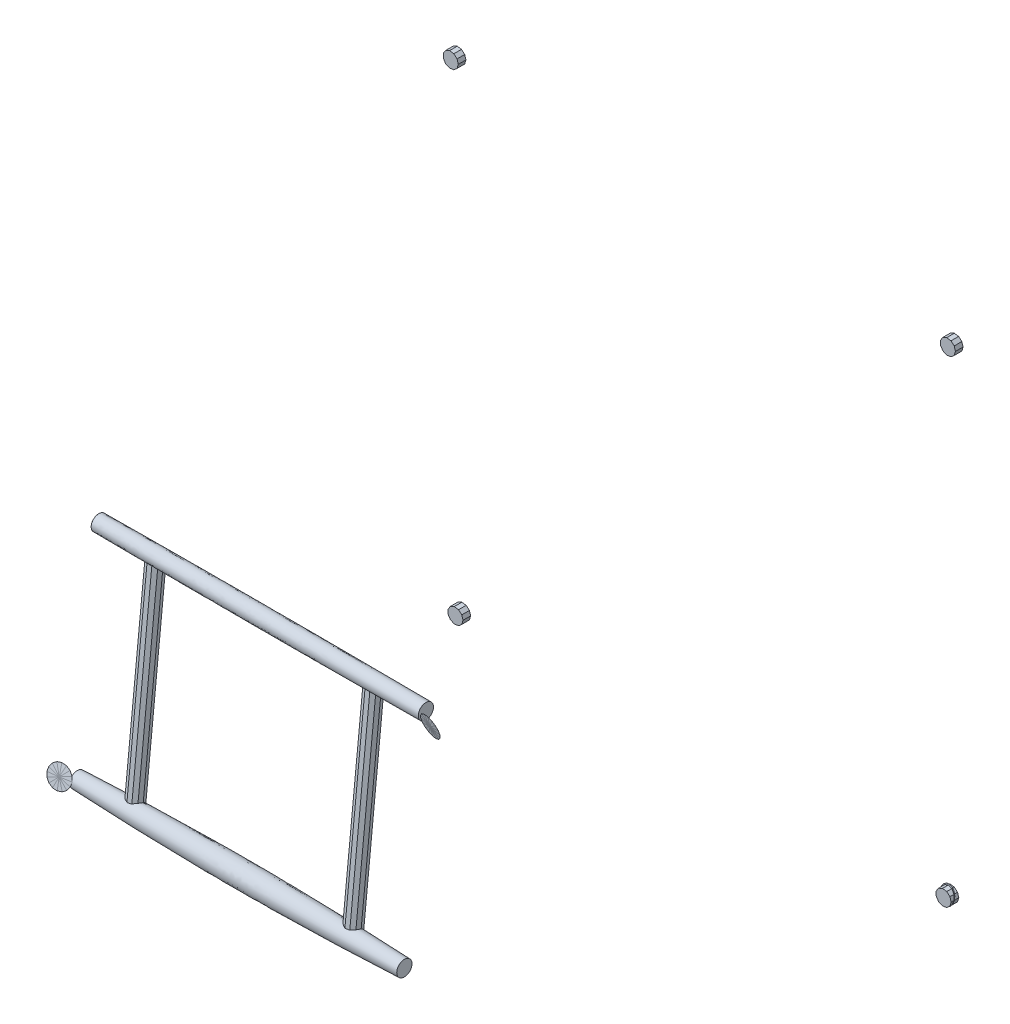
SolidWorks part; units mm, degrees
ref_plane "Front Plane" through (0, 0, 0) normal (0, 0, 1) x (1, 0, 0)
ref_plane "Top Plane" through (0, 0, 0) normal (0, 1, 0) x (1, 0, 0)
ref_plane "Right Plane" through (0, 0, 0) normal (1, 0, 0) x (0, 0, -1)
sketch3d "3DSketch1"
  point P0 (-4011.3284, -3135.5251, 11078.0385)
sketch3d "3DSketch2"
  line L0 (-4100.8815, -3367.9371, 11143.9539) -> (-4002.7371, -3386.8948, 11133.8925)
  line L1 (-4002.7371, -3386.8948, 11133.8925) -> (-3906.1054, -3367.9378, 11113.9922)
  line L2 (-3906.1054, -3367.9378, 11113.9922) -> (-3825.6983, -3313.9528, 11087.2845)
  line L3 (-3825.6983, -3313.9528, 11087.2845) -> (-3773.7569, -3233.1579, 11057.8351)
  line L4 (-3773.7569, -3233.1579, 11057.8351) -> (-3758.1884, -3137.8536, 11030.1267)
  line L5 (-3758.1884, -3137.8536, 11030.1267) -> (-3781.3638, -3042.5492, 11008.3777)
  line L6 (-3781.3638, -3042.5492, 11008.3777) -> (-3839.7544, -2961.7539, 10995.9001)
  line L7 (-3839.7544, -2961.7539, 10995.9001) -> (-3924.4705, -2907.7681, 10994.5932)
  line L8 (-3924.4705, -2907.7681, 10994.5932) -> (-4022.6153, -2888.8105, 11004.6554)
  line L9 (-4022.6153, -2888.8105, 11004.6554) -> (-4119.2466, -2907.7673, 11024.555)
  line L10 (-4119.2466, -2907.7673, 11024.555) -> (-4199.6537, -2961.7527, 11051.2627)
  line L11 (-4199.6537, -2961.7527, 11051.2627) -> (-4251.5955, -3042.5476, 11080.7128)
  line L12 (-4251.5955, -3042.5476, 11080.7128) -> (-4267.1636, -3137.8517, 11108.4212)
  line L13 (-4267.1636, -3137.8517, 11108.4212) -> (-4243.9882, -3233.1561, 11130.1695)
  line L14 (-4243.9882, -3233.1561, 11130.1695) -> (-4185.5976, -3313.9516, 11142.647)
  line L15 (-4185.5976, -3313.9516, 11142.647) -> (-4100.8815, -3367.9371, 11143.9539)
surface "Surface-Loft1"
ref_plane "Plane1" through (-2780.5426, 1110.1789, 117.7998) normal (0.928, -0.3705, -0.0393) x (-0.0365, 0.0146, -0.9992)
sketch "Sketch1" plane through (-2780.5426, 1110.1789, 117.7998) normal (0.928, -0.3705, -0.0393) x (-0.0365, 0.0146, -0.9992)
  line L0 (32.1132, -7827.8966) -> (-25.3057, -8022.7459)
  line L1 (-25.3057, -8022.7459) -> (-60.3834, -8082.0506)
  line L2 (-60.3834, -8082.0506) -> (-116.6243, -8114.8519)
  line L3 (-116.6243, -8114.8519) -> (-181.8273, -8114.0811)
  line L4 (-181.8273, -8114.0811) -> (-8895.174, -5506.4235)
  line L5 (-8895.174, -5506.4235) -> (-10946.1578, -4861.1682)
  line L6 (-10946.1578, -4861.1682) -> (-11023.5109, -4815.3473)
  line L7 (-11023.5109, -4815.3473) -> (-11049.7898, -4744.0102)
  line L8 (-11049.7898, -4744.0102) -> (-11034.7035, -4648.4633)
  line L9 (32.2165, -7833.1445) -> (-10959.9416, -4402.0803) construction
ref_plane "Plane2" through (5397.0302, -5491.5819, 2335.4013) normal (-0.6708, 0.6825, -0.2903) x (0.7417, 0.6173, -0.2625)
sketch3d "3DSketch8"
  line L0 (5542.3974, -6299.593, 99.4645) -> (5604.2719, -6341.1358, 120.0167)
  line L1 (5604.2719, -6341.1358, 120.0167) -> (5678.6309, -6355.7241, 135.3289)
  line L2 (5678.6309, -6355.7241, 135.3289) -> (5754.1542, -6341.1366, 143.0727)
  line L3 (5754.1542, -6341.1366, 143.0727) -> (5819.344, -6299.5945, 142.0669)
  line L4 (5819.344, -6299.5945, 142.0669) -> (5864.2769, -6237.422, 132.4656)
  line L5 (5864.2769, -6237.422, 132.4656) -> (5882.1115, -6164.0846, 115.7298)
  line L6 (5882.1115, -6164.0846, 115.7298) -> (5870.1324, -6090.7468, 94.4078)
  line L7 (5870.1324, -6090.7468, 94.4078) -> (5830.1627, -6028.5743, 71.746)
  line L8 (5830.1627, -6028.5743, 71.746) -> (5768.289, -5987.0315, 51.1942)
  line L9 (5768.289, -5987.0315, 51.1942) -> (5693.9307, -5972.4432, 35.8811)
  line L10 (5693.9307, -5972.4432, 35.8811) -> (5618.4067, -5987.0307, 28.1378)
  line L11 (5618.4067, -5987.0307, 28.1378) -> (5553.2169, -6028.5727, 29.1436)
  line L12 (5553.2169, -6028.5727, 29.1436) -> (5508.2847, -6090.7453, 38.7461)
  line L13 (5508.2847, -6090.7453, 38.7461) -> (5490.4501, -6164.0827, 55.4811)
  line L14 (5490.4501, -6164.0827, 55.4811) -> (5502.4293, -6237.4204, 76.8023)
  line L15 (5502.4293, -6237.4204, 76.8023) -> (5542.3974, -6299.593, 99.4645)
sketch3d "3DSketch9"
  line L0 (5689.6667, -6160.2546, 86.8118) -> (5688.1063, -6159.2078, 86.294)
  line L1 (5688.1063, -6159.2078, 86.294) -> (5686.2328, -6158.8407, 85.9072)
  line L2 (5686.2328, -6158.8407, 85.9072) -> (5684.3298, -6159.2085, 85.7126)
  line L3 (5684.3298, -6159.2085, 85.7126) -> (5682.6872, -6160.2558, 85.7374)
  line L4 (5682.6872, -6160.2558, 85.7374) -> (5681.5548, -6161.8231, 85.9796)
  line L5 (5681.5548, -6161.8231, 85.9796) -> (5681.1052, -6163.6715, 86.4017)
  line L6 (5681.1052, -6163.6715, 86.4017) -> (5681.4075, -6165.5198, 86.9393)
  line L7 (5681.4075, -6165.5198, 86.9393) -> (5682.4152, -6167.0864, 87.5102)
  line L8 (5682.4152, -6167.0864, 87.5102) -> (5683.9748, -6168.1332, 88.0287)
  line L9 (5683.9748, -6168.1332, 88.0287) -> (5685.8491, -6168.5002, 88.4144)
  line L10 (5685.8491, -6168.5002, 88.4144) -> (5687.7528, -6168.1324, 88.6093)
  line L11 (5687.7528, -6168.1324, 88.6093) -> (5689.3961, -6167.0852, 88.5837)
  line L12 (5689.3961, -6167.0852, 88.5837) -> (5690.5279, -6165.5182, 88.3411)
  line L13 (5690.5279, -6165.5182, 88.3411) -> (5690.9767, -6163.6695, 87.9194)
  line L14 (5690.9767, -6163.6695, 87.9194) -> (5690.6744, -6161.8212, 87.3823)
  line L15 (5690.6744, -6161.8212, 87.3823) -> (5689.6667, -6160.2546, 86.8118)
surface "Surface-Loft4"
sketch3d "3DSketch10"
  point P0 (4103.265, 1668.8024, 10555.9231)
sketch3d "3DSketch11"
  line L0 (4219.8471, 1885.8136, 10631.386) -> (4124.1661, 1915.9187, 10625.7592)
  line L1 (4124.1661, 1915.9187, 10625.7592) -> (4025.507, 1908.8091, 10608.1804)
  line L2 (4025.507, 1908.8091, 10608.1804) -> (3938.8921, 1865.5683, 10581.3278)
  line L3 (3938.8921, 1865.5683, 10581.3278) -> (3877.5075, 1792.7797, 10549.2863)
  line L4 (3877.5075, 1792.7797, 10549.2863) -> (3850.6967, 1701.5221, 10516.9379)
  line L5 (3850.6967, 1701.5221, 10516.9379) -> (3862.5433, 1605.6915, 10489.2055)
  line L6 (3862.5433, 1605.6915, 10489.2055) -> (3911.2434, 1519.8762, 10470.3097)
  line L7 (3911.2434, 1519.8762, 10470.3097) -> (3989.3828, 1457.1409, 10463.1288)
  line L8 (3989.3828, 1457.1409, 10463.1288) -> (4085.0646, 1427.0358, 10468.7556)
  line L9 (4085.0646, 1427.0358, 10468.7556) -> (4183.7229, 1434.1454, 10486.3351)
  line L10 (4183.7229, 1434.1454, 10486.3351) -> (4270.3378, 1477.3862, 10513.1877)
  line L11 (4270.3378, 1477.3862, 10513.1877) -> (4331.7232, 1550.1755, 10545.2276)
  line L12 (4331.7232, 1550.1755, 10545.2276) -> (4358.5332, 1641.432, 10577.5776)
  line L13 (4358.5332, 1641.432, 10577.5776) -> (4346.6866, 1737.263, 10605.3093)
  line L14 (4346.6866, 1737.263, 10605.3093) -> (4297.9865, 1823.0779, 10624.2058)
  line L15 (4297.9865, 1823.0779, 10624.2058) -> (4219.8471, 1885.8136, 10631.386)
surface "Surface-Loft5"
ref_plane "Plane3" through (2425.8124, -1296.1232, -21.3912) normal (-0.882, 0.4712, 0.0078) x (0.0069, -0.0037, 1)
sketch "Sketch2" plane through (2425.8124, -1296.1232, -21.3912) normal (-0.882, 0.4712, 0.0078) x (0.0069, -0.0037, 1)
  line L0 (89.1239, 7140.6124) -> (153.9574, 7333.1233)
  line L1 (153.9574, 7333.1233) -> (191.2787, 7391.0421)
  line L2 (191.2787, 7391.0421) -> (248.7343, 7421.6672)
  line L3 (248.7343, 7421.6672) -> (313.8614, 7418.4023)
  line L4 (313.8614, 7418.4023) -> (8547.9888, 4591.107)
  line L5 (8547.9888, 4591.107) -> (10572.7564, 3867.8432)
  line L6 (10572.7564, 3867.8432) -> (10648.2999, 3819.0963)
  line L7 (10648.2999, 3819.0963) -> (10671.8303, 3746.8053)
  line L8 (10671.8303, 3746.8053) -> (10653.0992, 3651.9066)
  line L9 (89.2232, 7145.864) -> (10568.9689, 3408.5664) construction
ref_plane "Plane4" through (-5460.521, 4290.7233, 2245.6333) normal (-0.7482, 0.5879, 0.3077) x (0.2419, -0.1901, 0.9515)
ref_plane "Plane5" through (-0.0022, -3863.0157, 10613.6432) normal (0, -0.342, 0.9397) x (1, 0, 0)
sketch "Sketch3" plane through (-0.0022, -3863.0157, 10613.6432) normal (0, -0.342, 0.9397) x (1, 0, 0)
  line L0 (-3811.6669, 710.1611) -> (3808.3403, 710.1581) construction
  spline S0 degree 3 poles (-3811.6612, 532.3591) (-2796.1845, 489.7811) (-1272.0775, 451.4266) (1268.7563, 451.4258) (2792.8635, 489.7803) (3808.3403, 532.3582) knots 0 0 0 0 0.400028 0.599972 1 1 1 1
surface "Surface-Revolve3" sketch "Sketch3" parameters "D1"=360
ref_plane "Plane6" through (3808.3381, 0, 0) normal (-1, 0, 0) x (0, 0, 1)
sketch "Sketch4" plane through (3808.3381, 0, 0) normal (-1, 0, 0) x (0, 0, 1)
  circle A0 centre (10856.5306, -3195.6834) radius 177.8014
surface "Surface-Plane1" sketch "Sketch4"
ref_plane "Plane7" through (-3812.3562, -0.2111, 0.1771) normal (1, 0.0001, 0) x (0, 0, -1)
sketch "Sketch5" plane through (-3812.3562, -0.2111, 0.1771) normal (1, 0.0001, 0) x (0, 0, -1)
  circle A0 centre (-10856.3528, -3195.4705) radius 177.8021
surface "Surface-Plane2" sketch "Sketch5"
ref_plane "Plane8" through (-0.0018, -3125.0325, 8586.0328) normal (0, -0.342, 0.9397) x (1, 0, 0)
sketch "Sketch6" plane through (-0.0018, -3125.0325, 8586.0328) normal (0, -0.342, 0.9397) x (1, 0, 0)
  line L0 (-3811.6673, 5172.4948) -> (3808.3399, 5172.4918) construction
  spline S0 degree 3 poles (-3811.6616, 4994.6928) (-2795.6732, 4988.3224) (-1271.6707, 4982.588) (1268.3485, 4982.5875) (2792.3513, 4988.3208) (3808.3399, 4994.692) knots 0 0 0 0 0.400001 0.599999 1 1 1 1
surface "Surface-Revolve4" sketch "Sketch6" parameters "D1"=360
sketch "Sketch7" plane through (3808.3381, 0, 0) normal (-1, 0, 0) x (0, 0, 1)
  circle A0 centre (10355.1158, 1735.5238) radius 177.7989
surface "Surface-Plane3" sketch "Sketch7"
sketch "Sketch8" plane through (-3812.3562, -0.2111, 0.1771) normal (1, 0.0001, 0) x (0, 0, -1)
  circle A0 centre (-10354.9385, 1735.7392) radius 177.8021
surface "Surface-Plane4" sketch "Sketch8"
sketch3d "3DSketch17"
  line L0 (-2390.7955, -3187.2384, 10885.6061) -> (-2362.5705, -3187.2384, 10789.4802)
  line L1 (-2362.5705, -3187.2384, 10789.4802) -> (-2390.7955, -3187.2384, 10693.3543)
  line L2 (-2390.7955, -3187.2384, 10693.3543) -> (-2466.5099, -3187.2384, 10627.7474)
  line L3 (-2466.5099, -3187.2384, 10627.7474) -> (-2565.674, -3187.2384, 10613.4894)
  line L4 (-2565.674, -3187.2384, 10613.4894) -> (-2656.8049, -3187.2384, 10655.1078)
  line L5 (-2656.8049, -3187.2384, 10655.1078) -> (-2710.9686, -3187.2384, 10739.3879)
  line L6 (-2710.9686, -3187.2384, 10739.3879) -> (-2710.9686, -3187.2384, 10839.5717)
  line L7 (-2710.9686, -3187.2384, 10839.5717) -> (-2656.8049, -3187.2384, 10923.8518)
  line L8 (-2656.8049, -3187.2384, 10923.8518) -> (-2565.674, -3187.2384, 10965.4702)
  line L9 (-2565.674, -3187.2384, 10965.4702) -> (-2466.5095, -3187.2384, 10951.2122)
  line L10 (-2466.5095, -3187.2384, 10951.2122) -> (-2390.7955, -3187.2384, 10885.6061)
sketch3d "3DSketch18"
  line L0 (-2390.7955, 1733.9963, 10385.5157) -> (-2362.5705, 1733.9963, 10289.3898)
  line L1 (-2362.5705, 1733.9963, 10289.3898) -> (-2390.7955, 1733.9963, 10193.2639)
  line L2 (-2390.7955, 1733.9963, 10193.2639) -> (-2466.5099, 1733.9963, 10127.657)
  line L3 (-2466.5099, 1733.9963, 10127.657) -> (-2565.674, 1733.9963, 10113.399)
  line L4 (-2565.674, 1733.9963, 10113.399) -> (-2656.8049, 1733.9963, 10155.0174)
  line L5 (-2656.8049, 1733.9963, 10155.0174) -> (-2710.9686, 1733.9963, 10239.2975)
  line L6 (-2710.9686, 1733.9963, 10239.2975) -> (-2710.9686, 1733.9963, 10339.4813)
  line L7 (-2710.9686, 1733.9963, 10339.4813) -> (-2656.8049, 1733.9963, 10423.7614)
  line L8 (-2656.8049, 1733.9963, 10423.7614) -> (-2565.674, 1733.9963, 10465.3798)
  line L9 (-2565.674, 1733.9963, 10465.3798) -> (-2466.5099, 1733.9963, 10451.1218)
  line L10 (-2466.5099, 1733.9963, 10451.1218) -> (-2390.7955, 1733.9963, 10385.5157)
surface "Surface-Loft8"
ref_plane "Plane9" through (0, -3187.2384, 0) normal (0, 1, 0) x (1, 0, 0)
sketch "Sketch9" plane through (0, -3187.2384, 0) normal (0, 1, 0) x (1, 0, 0)
  line L0 (-2466.5095, -10951.2122) -> (-2390.7955, -10885.6061)
  line L1 (-2390.7955, -10885.6061) -> (-2362.5705, -10789.4802)
  line L2 (-2362.5705, -10789.4802) -> (-2390.7955, -10693.3543)
  line L3 (-2390.7955, -10693.3543) -> (-2466.5099, -10627.7474)
  line L4 (-2466.5099, -10627.7474) -> (-2565.674, -10613.4894)
  line L5 (-2565.674, -10613.4894) -> (-2656.8049, -10655.1078)
  line L6 (-2656.8049, -10655.1078) -> (-2710.9686, -10739.3879)
  line L7 (-2710.9686, -10739.3879) -> (-2710.9686, -10839.5717)
  line L8 (-2710.9686, -10839.5717) -> (-2656.8049, -10923.8518)
  line L9 (-2656.8049, -10923.8518) -> (-2565.674, -10965.4702)
  line L10 (-2565.674, -10965.4702) -> (-2466.5095, -10951.2122)
surface "Surface-Plane5" sketch "Sketch9"
ref_plane "Plane10" through (0, 1733.9963, 0) normal (0, -1, 0) x (-1, 0, 0)
sketch "Sketch10" plane through (0, 1733.9963, 0) normal (0, -1, 0) x (-1, 0, 0)
  line L0 (2390.7955, -10193.2639) -> (2362.5705, -10289.3898)
  line L1 (2362.5705, -10289.3898) -> (2390.7955, -10385.5157)
  line L2 (2390.7955, -10385.5157) -> (2466.5099, -10451.1218)
  line L3 (2466.5099, -10451.1218) -> (2565.674, -10465.3798)
  line L4 (2565.674, -10465.3798) -> (2656.8049, -10423.7614)
  line L5 (2656.8049, -10423.7614) -> (2710.9686, -10339.4813)
  line L6 (2710.9686, -10339.4813) -> (2710.9686, -10239.2975)
  line L7 (2710.9686, -10239.2975) -> (2656.8049, -10155.0174)
  line L8 (2656.8049, -10155.0174) -> (2565.674, -10113.399)
  line L9 (2565.674, -10113.399) -> (2466.5099, -10127.657)
  line L10 (2466.5099, -10127.657) -> (2390.7955, -10193.2639)
surface "Surface-Plane6" sketch "Sketch10"
sketch3d "3DSketch19"
  line L0 (2687.3069, -3187.2384, 10885.6061) -> (2715.5319, -3187.2384, 10789.4802)
  line L1 (2715.5319, -3187.2384, 10789.4802) -> (2687.3069, -3187.2384, 10693.3543)
  line L2 (2687.3069, -3187.2384, 10693.3543) -> (2611.5927, -3187.2384, 10627.7474)
  line L3 (2611.5927, -3187.2384, 10627.7474) -> (2512.4284, -3187.2384, 10613.4901)
  line L4 (2512.4284, -3187.2384, 10613.4901) -> (2421.2976, -3187.2384, 10655.1078)
  line L5 (2421.2976, -3187.2384, 10655.1078) -> (2367.1342, -3187.2384, 10739.3879)
  line L6 (2367.1342, -3187.2384, 10739.3879) -> (2367.1342, -3187.2384, 10839.5725)
  line L7 (2367.1342, -3187.2384, 10839.5725) -> (2421.2977, -3187.2384, 10923.8526)
  line L8 (2421.2977, -3187.2384, 10923.8526) -> (2512.4284, -3187.2384, 10965.4702)
  line L9 (2512.4284, -3187.2384, 10965.4702) -> (2611.5927, -3187.2384, 10951.2129)
  line L10 (2611.5927, -3187.2384, 10951.2129) -> (2687.3069, -3187.2384, 10885.6061)
sketch3d "3DSketch20"
  line L0 (2687.3069, 1733.9959, 10385.5157) -> (2715.5319, 1733.9959, 10289.3898)
  line L1 (2715.5319, 1733.9959, 10289.3898) -> (2687.3069, 1733.9959, 10193.2639)
  line L2 (2687.3069, 1733.9959, 10193.2639) -> (2611.5927, 1733.9963, 10127.657)
  line L3 (2611.5927, 1733.9963, 10127.657) -> (2512.4284, 1733.9963, 10113.3997)
  line L4 (2512.4284, 1733.9963, 10113.3997) -> (2421.2977, 1733.9963, 10155.0174)
  line L5 (2421.2977, 1733.9963, 10155.0174) -> (2367.1342, 1733.9963, 10239.2975)
  line L6 (2367.1342, 1733.9963, 10239.2975) -> (2367.1342, 1733.9963, 10339.4821)
  line L7 (2367.1342, 1733.9963, 10339.4821) -> (2421.2977, 1733.9963, 10423.7622)
  line L8 (2421.2977, 1733.9963, 10423.7622) -> (2512.4284, 1733.9963, 10465.3798)
  line L9 (2512.4284, 1733.9963, 10465.3798) -> (2611.5927, 1733.9963, 10451.1225)
  line L10 (2611.5927, 1733.9963, 10451.1225) -> (2687.3069, 1733.9959, 10385.5157)
surface "Surface-Loft9"
sketch "Sketch11" plane through (0, -3187.2384, 0) normal (0, 1, 0) x (1, 0, 0)
  line L0 (2611.5927, -10951.2129) -> (2687.3069, -10885.6061)
  line L1 (2687.3069, -10885.6061) -> (2715.5319, -10789.4802)
  line L2 (2715.5319, -10789.4802) -> (2687.3069, -10693.3543)
  line L3 (2687.3069, -10693.3543) -> (2611.5927, -10627.7474)
  line L4 (2611.5927, -10627.7474) -> (2512.4284, -10613.4901)
  line L5 (2512.4284, -10613.4901) -> (2421.2976, -10655.1078)
  line L6 (2421.2976, -10655.1078) -> (2367.1342, -10739.3879)
  line L7 (2367.1342, -10739.3879) -> (2367.1342, -10839.5725)
  line L8 (2367.1342, -10839.5725) -> (2421.2977, -10923.8526)
  line L9 (2421.2977, -10923.8526) -> (2512.4284, -10965.4702)
  line L10 (2512.4284, -10965.4702) -> (2611.5927, -10951.2129)
surface "Surface-Plane7" sketch "Sketch11"
sketch "Sketch12" plane through (0, 1733.9963, 0) normal (0, -1, 0) x (-1, 0, 0)
  line L0 (-2687.3069, -10193.2639) -> (-2715.5319, -10289.3898)
  line L1 (-2715.5319, -10289.3898) -> (-2687.3069, -10385.5157)
  line L2 (-2687.3069, -10385.5157) -> (-2611.5927, -10451.1225)
  line L3 (-2611.5927, -10451.1225) -> (-2512.4284, -10465.3798)
  line L4 (-2512.4284, -10465.3798) -> (-2421.2977, -10423.7622)
  line L5 (-2421.2977, -10423.7622) -> (-2367.1342, -10339.4821)
  line L6 (-2367.1342, -10339.4821) -> (-2367.1342, -10239.2975)
  line L7 (-2367.1342, -10239.2975) -> (-2421.2977, -10155.0174)
  line L8 (-2421.2977, -10155.0174) -> (-2512.4284, -10113.3997)
  line L9 (-2512.4284, -10113.3997) -> (-2611.5927, -10127.657)
  line L10 (-2611.5927, -10127.657) -> (-2687.3069, -10193.2639)
surface "Surface-Plane8" sketch "Sketch12"
ref_plane "Plane11" through (0, 0, 0) normal (0, 0, 1) x (1, 0, 0)
sketch "Sketch13" plane through (0, 0, 0) normal (0, 0, 1) x (1, 0, 0)
  line L0 (-5532.3701, -6269.7805) -> (-5504.145, -6173.6546)
  line L1 (-5504.145, -6173.6546) -> (-5532.3701, -6077.5286)
  line L2 (-5532.3701, -6077.5286) -> (-5608.0844, -6011.9222)
  line L3 (-5608.0844, -6011.9222) -> (-5707.2485, -5997.6641)
  line L4 (-5707.2485, -5997.6641) -> (-5798.3794, -6039.2821)
  line L5 (-5798.3794, -6039.2821) -> (-5852.5428, -6123.5627)
  line L6 (-5852.5428, -6123.5627) -> (-5852.5428, -6223.7465)
  line L7 (-5852.5428, -6223.7465) -> (-5798.3794, -6308.027)
  line L8 (-5798.3794, -6308.027) -> (-5707.2485, -6349.645)
  line L9 (-5707.2485, -6349.645) -> (-5608.084, -6335.3869)
  line L10 (-5608.084, -6335.3869) -> (-5532.3701, -6269.7805)
surface "Surface-Extrude1" sketch "Sketch13" parameters "D1"=177.8, "D2"=0, "D3"=0, "D4"=0
sketch "Sketch14" plane through (0, 0, 0) normal (0, 0, 1) x (1, 0, 0)
  line L0 (-5608.084, -6335.3869) -> (-5532.3701, -6269.7805)
  line L1 (-5532.3701, -6269.7805) -> (-5504.145, -6173.6546)
  line L2 (-5504.145, -6173.6546) -> (-5532.3701, -6077.5286)
  line L3 (-5532.3701, -6077.5286) -> (-5608.0844, -6011.9222)
  line L4 (-5608.0844, -6011.9222) -> (-5707.2485, -5997.6641)
  line L5 (-5707.2485, -5997.6641) -> (-5798.3794, -6039.2821)
  line L6 (-5798.3794, -6039.2821) -> (-5852.5428, -6123.5627)
  line L7 (-5852.5428, -6123.5627) -> (-5852.5428, -6223.7465)
  line L8 (-5852.5428, -6223.7465) -> (-5798.3794, -6308.027)
  line L9 (-5798.3794, -6308.027) -> (-5707.2485, -6349.645)
  line L10 (-5707.2485, -6349.645) -> (-5608.084, -6335.3869)
surface "Surface-Plane9" sketch "Sketch14"
ref_plane "Plane12" through (0, 0, 177.8) normal (0, 0, -1) x (-1, 0, 0)
sketch "Sketch15" plane through (0, 0, 177.8) normal (0, 0, -1) x (-1, 0, 0)
  line L0 (5532.3701, -6077.5286) -> (5504.145, -6173.6546)
  line L1 (5504.145, -6173.6546) -> (5532.3701, -6269.7805)
  line L2 (5532.3701, -6269.7805) -> (5608.084, -6335.3869)
  line L3 (5608.084, -6335.3869) -> (5707.2485, -6349.645)
  line L4 (5707.2485, -6349.645) -> (5798.3794, -6308.027)
  line L5 (5798.3794, -6308.027) -> (5852.5428, -6223.7465)
  line L6 (5852.5428, -6223.7465) -> (5852.5428, -6123.5627)
  line L7 (5852.5428, -6123.5627) -> (5798.3794, -6039.2821)
  line L8 (5798.3794, -6039.2821) -> (5707.2485, -5997.6641)
  line L9 (5707.2485, -5997.6641) -> (5608.0844, -6011.9222)
  line L10 (5608.0844, -6011.9222) -> (5532.3701, -6077.5286)
surface "Surface-Plane10" sketch "Sketch15"
sketch "Sketch16" plane through (0, 0, 0) normal (0, 0, 1) x (1, 0, 0)
  line L0 (5839.492, -6269.7805) -> (5867.7174, -6173.6546)
  line L1 (5867.7174, -6173.6546) -> (5839.492, -6077.5286)
  line L2 (5839.492, -6077.5286) -> (5763.778, -6011.9222)
  line L3 (5763.778, -6011.9222) -> (5664.6135, -5997.6641)
  line L4 (5664.6135, -5997.6641) -> (5573.4834, -6039.2821)
  line L5 (5573.4834, -6039.2821) -> (5519.3193, -6123.5627)
  line L6 (5519.3193, -6123.5627) -> (5519.3193, -6223.7465)
  line L7 (5519.3193, -6223.7465) -> (5573.4834, -6308.027)
  line L8 (5573.4834, -6308.027) -> (5664.6135, -6349.645)
  line L9 (5664.6135, -6349.645) -> (5763.778, -6335.3869)
  line L10 (5763.778, -6335.3869) -> (5839.492, -6269.7805)
surface "Surface-Extrude2" sketch "Sketch16" parameters "D1"=177.8, "D2"=0, "D3"=0, "D4"=0
sketch "Sketch17" plane through (0, 0, 0) normal (0, 0, 1) x (1, 0, 0)
  line L0 (5763.778, -6335.3869) -> (5839.492, -6269.7805)
  line L1 (5839.492, -6269.7805) -> (5867.7174, -6173.6546)
  line L2 (5867.7174, -6173.6546) -> (5839.492, -6077.5286)
  line L3 (5839.492, -6077.5286) -> (5763.778, -6011.9222)
  line L4 (5763.778, -6011.9222) -> (5664.6135, -5997.6641)
  line L5 (5664.6135, -5997.6641) -> (5573.4834, -6039.2821)
  line L6 (5573.4834, -6039.2821) -> (5519.3193, -6123.5627)
  line L7 (5519.3193, -6123.5627) -> (5519.3193, -6223.7465)
  line L8 (5519.3193, -6223.7465) -> (5573.4834, -6308.027)
  line L9 (5573.4834, -6308.027) -> (5664.6135, -6349.645)
  line L10 (5664.6135, -6349.645) -> (5763.778, -6335.3869)
surface "Surface-Plane11" sketch "Sketch17"
sketch "Sketch18" plane through (0, 0, 177.8) normal (0, 0, -1) x (-1, 0, 0)
  line L0 (-5839.492, -6077.5286) -> (-5867.7174, -6173.6546)
  line L1 (-5867.7174, -6173.6546) -> (-5839.492, -6269.7805)
  line L2 (-5839.492, -6269.7805) -> (-5763.778, -6335.3869)
  line L3 (-5763.778, -6335.3869) -> (-5664.6135, -6349.645)
  line L4 (-5664.6135, -6349.645) -> (-5573.4834, -6308.027)
  line L5 (-5573.4834, -6308.027) -> (-5519.3193, -6223.7465)
  line L6 (-5519.3193, -6223.7465) -> (-5519.3193, -6123.5627)
  line L7 (-5519.3193, -6123.5627) -> (-5573.4834, -6039.2821)
  line L8 (-5573.4834, -6039.2821) -> (-5664.6135, -5997.6641)
  line L9 (-5664.6135, -5997.6641) -> (-5763.778, -6011.9222)
  line L10 (-5763.778, -6011.9222) -> (-5839.492, -6077.5286)
surface "Surface-Plane12" sketch "Sketch18"
sketch "Sketch19" plane through (0, 0, 0) normal (0, 0, 1) x (1, 0, 0)
  line L0 (5939.6316, 4891.8917) -> (5967.857, 4988.0176)
  line L1 (5967.857, 4988.0176) -> (5939.6316, 5084.1435)
  line L2 (5939.6316, 5084.1435) -> (5863.9177, 5149.7504)
  line L3 (5863.9177, 5149.7504) -> (5764.7532, 5164.0077)
  line L4 (5764.7532, 5164.0077) -> (5673.6231, 5122.39)
  line L5 (5673.6231, 5122.39) -> (5619.4589, 5038.1099)
  line L6 (5619.4589, 5038.1099) -> (5619.4589, 4937.9253)
  line L7 (5619.4589, 4937.9253) -> (5673.6231, 4853.6452)
  line L8 (5673.6231, 4853.6452) -> (5764.7532, 4812.0276)
  line L9 (5764.7532, 4812.0276) -> (5863.9177, 4826.2849)
  line L10 (5863.9177, 4826.2849) -> (5939.6316, 4891.8917)
surface "Surface-Extrude3" sketch "Sketch19" parameters "D1"=177.8, "D2"=0, "D3"=0, "D4"=0
sketch "Sketch20" plane through (0, 0, 0) normal (0, 0, 1) x (1, 0, 0)
  line L0 (5863.9177, 4826.2849) -> (5939.6316, 4891.8917)
  line L1 (5939.6316, 4891.8917) -> (5967.857, 4988.0176)
  line L2 (5967.857, 4988.0176) -> (5939.6316, 5084.1435)
  line L3 (5939.6316, 5084.1435) -> (5863.9177, 5149.7504)
  line L4 (5863.9177, 5149.7504) -> (5764.7532, 5164.0077)
  line L5 (5764.7532, 5164.0077) -> (5673.6231, 5122.39)
  line L6 (5673.6231, 5122.39) -> (5619.4589, 5038.1099)
  line L7 (5619.4589, 5038.1099) -> (5619.4589, 4937.9253)
  line L8 (5619.4589, 4937.9253) -> (5673.6231, 4853.6452)
  line L9 (5673.6231, 4853.6452) -> (5764.7532, 4812.0276)
  line L10 (5764.7532, 4812.0276) -> (5863.9177, 4826.2849)
surface "Surface-Plane13" sketch "Sketch20"
sketch "Sketch21" plane through (0, 0, 177.8) normal (0, 0, -1) x (-1, 0, 0)
  line L0 (-5939.6316, 5084.1435) -> (-5967.857, 4988.0176)
  line L1 (-5967.857, 4988.0176) -> (-5939.6316, 4891.8917)
  line L2 (-5939.6316, 4891.8917) -> (-5863.9177, 4826.2849)
  line L3 (-5863.9177, 4826.2849) -> (-5764.7532, 4812.0276)
  line L4 (-5764.7532, 4812.0276) -> (-5673.6231, 4853.6452)
  line L5 (-5673.6231, 4853.6452) -> (-5619.4589, 4937.9253)
  line L6 (-5619.4589, 4937.9253) -> (-5619.4589, 5038.1099)
  line L7 (-5619.4589, 5038.1099) -> (-5673.6231, 5122.39)
  line L8 (-5673.6231, 5122.39) -> (-5764.7532, 5164.0077)
  line L9 (-5764.7532, 5164.0077) -> (-5863.9177, 5149.7504)
  line L10 (-5863.9177, 5149.7504) -> (-5939.6316, 5084.1435)
surface "Surface-Plane14" sketch "Sketch21"
sketch "Sketch22" plane through (0, 0, 0) normal (0, 0, 1) x (1, 0, 0)
  line L0 (-5642.6005, 4891.8917) -> (-5614.3755, 4988.0176)
  line L1 (-5614.3755, 4988.0176) -> (-5642.6005, 5084.1435)
  line L2 (-5642.6005, 5084.1435) -> (-5718.3149, 5149.7504)
  line L3 (-5718.3149, 5149.7504) -> (-5817.479, 5164.0077)
  line L4 (-5817.479, 5164.0077) -> (-5908.6099, 5122.39)
  line L5 (-5908.6099, 5122.39) -> (-5962.7732, 5038.1099)
  line L6 (-5962.7732, 5038.1099) -> (-5962.7732, 4937.9253)
  line L7 (-5962.7732, 4937.9253) -> (-5908.6099, 4853.6452)
  line L8 (-5908.6099, 4853.6452) -> (-5817.479, 4812.0276)
  line L9 (-5817.479, 4812.0276) -> (-5718.3145, 4826.2849)
  line L10 (-5718.3145, 4826.2849) -> (-5642.6005, 4891.8917)
surface "Surface-Extrude4" sketch "Sketch22" parameters "D1"=177.8, "D2"=0, "D3"=0, "D4"=0
sketch "Sketch23" plane through (0, 0, 0) normal (0, 0, 1) x (1, 0, 0)
  line L0 (-5718.3145, 4826.2849) -> (-5642.6005, 4891.8917)
  line L1 (-5642.6005, 4891.8917) -> (-5614.3755, 4988.0176)
  line L2 (-5614.3755, 4988.0176) -> (-5642.6005, 5084.1435)
  line L3 (-5642.6005, 5084.1435) -> (-5718.3149, 5149.7504)
  line L4 (-5718.3149, 5149.7504) -> (-5817.479, 5164.0077)
  line L5 (-5817.479, 5164.0077) -> (-5908.6099, 5122.39)
  line L6 (-5908.6099, 5122.39) -> (-5962.7732, 5038.1099)
  line L7 (-5962.7732, 5038.1099) -> (-5962.7732, 4937.9253)
  line L8 (-5962.7732, 4937.9253) -> (-5908.6099, 4853.6452)
  line L9 (-5908.6099, 4853.6452) -> (-5817.479, 4812.0276)
  line L10 (-5817.479, 4812.0276) -> (-5718.3145, 4826.2849)
surface "Surface-Plane15" sketch "Sketch23"
sketch "Sketch24" plane through (0, 0, 177.8) normal (0, 0, -1) x (-1, 0, 0)
  line L0 (5642.6005, 5084.1435) -> (5614.3755, 4988.0176)
  line L1 (5614.3755, 4988.0176) -> (5642.6005, 4891.8917)
  line L2 (5642.6005, 4891.8917) -> (5718.3145, 4826.2849)
  line L3 (5718.3145, 4826.2849) -> (5817.479, 4812.0276)
  line L4 (5817.479, 4812.0276) -> (5908.6099, 4853.6452)
  line L5 (5908.6099, 4853.6452) -> (5962.7732, 4937.9253)
  line L6 (5962.7732, 4937.9253) -> (5962.7732, 5038.1099)
  line L7 (5962.7732, 5038.1099) -> (5908.6099, 5122.39)
  line L8 (5908.6099, 5122.39) -> (5817.479, 5164.0077)
  line L9 (5817.479, 5164.0077) -> (5718.3149, 5149.7504)
  line L10 (5718.3149, 5149.7504) -> (5642.6005, 5084.1435)
surface "Surface-Plane16" sketch "Sketch24"
